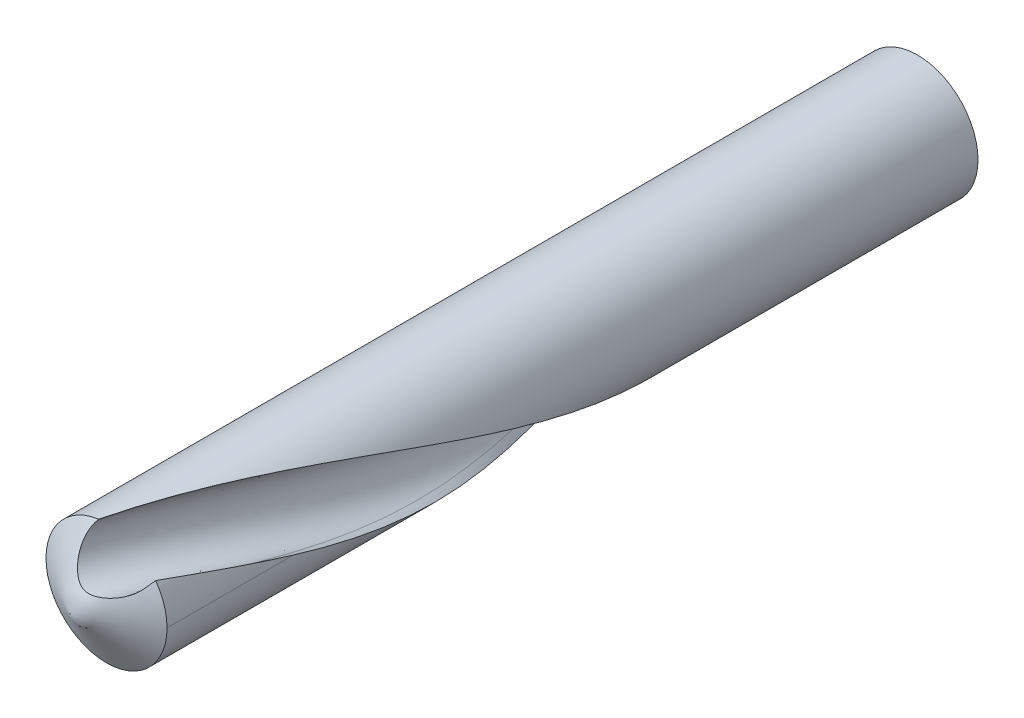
SolidWorks part; units mm, degrees
ref_plane "Front Plane" through (0, 0, 0) normal (0, 0, 1) x (1, 0, 0)
ref_plane "Top Plane" through (0, 0, 0) normal (0, 1, 0) x (1, 0, 0)
ref_plane "Right Plane" through (0, 0, 0) normal (1, 0, 0) x (0, 0, -1)
sketch "Sketch1" plane through (0, 0, 0) normal (1, 0, 0) x (0, 0, -1)
  line L0 (0, 0) -> (-140, 0)
  line L1 (-140, 0) -> (-133.9914, 10)
  line L2 (-133.9914, 10) -> (0, 10)
  line L3 (0, 10) -> (0, 0)
  line L4 (0, 0) -> (7.3997, 0) construction
  line L5 (-140, 0) -> (-133.9914, -10) construction
  dimension "D1" = 118
  dimension "D2" = 20
  dimension "D3" = 140
revolve "Revolve1" add sketch "Sketch1" angle 360 about L4
ref_plane "Plane1" through (0, 0, 140) normal (0, 0, 1) x (1, 0, 0)
sketch "Sketch2" plane through (0, 0, 140) normal (0, 0, 1) x (1, 0, 0)
  circle A0 centre (0, 0) radius 3
  dimension "D1" = 6
curve "Helix/Spiral1"
ref_plane "Plane2" through (0, 3, 140) normal (0.0894, 0, -0.996) x (-0.996, 0, -0.0894)
sketch "Sketch4" plane through (0, 3, 140) normal (0.0894, 0, -0.996) x (-0.996, 0, -0.0894)
  line L0 (0, 0) -> (-8, 22.6274) construction
  line L1 (-3.286, 24.2941) -> (3.0474, 6.3807)
  line L2 (-12.714, 20.9608) -> (-6.3807, 3.0474)
  line L3 (-3.286, 24.2941) -> (-12.714, 20.9608)
  arc A0 (3.0474, 6.3807) -> (-6.3807, 3.0474) centre (-1.6667, 4.714) cw
  dimension "D1" = 5
  dimension "D2" = 24
  dimension "D3" = 1
sweep "Cut-Sweep1" cut profiles "Sketch4" path "Helix/Spiral1"
